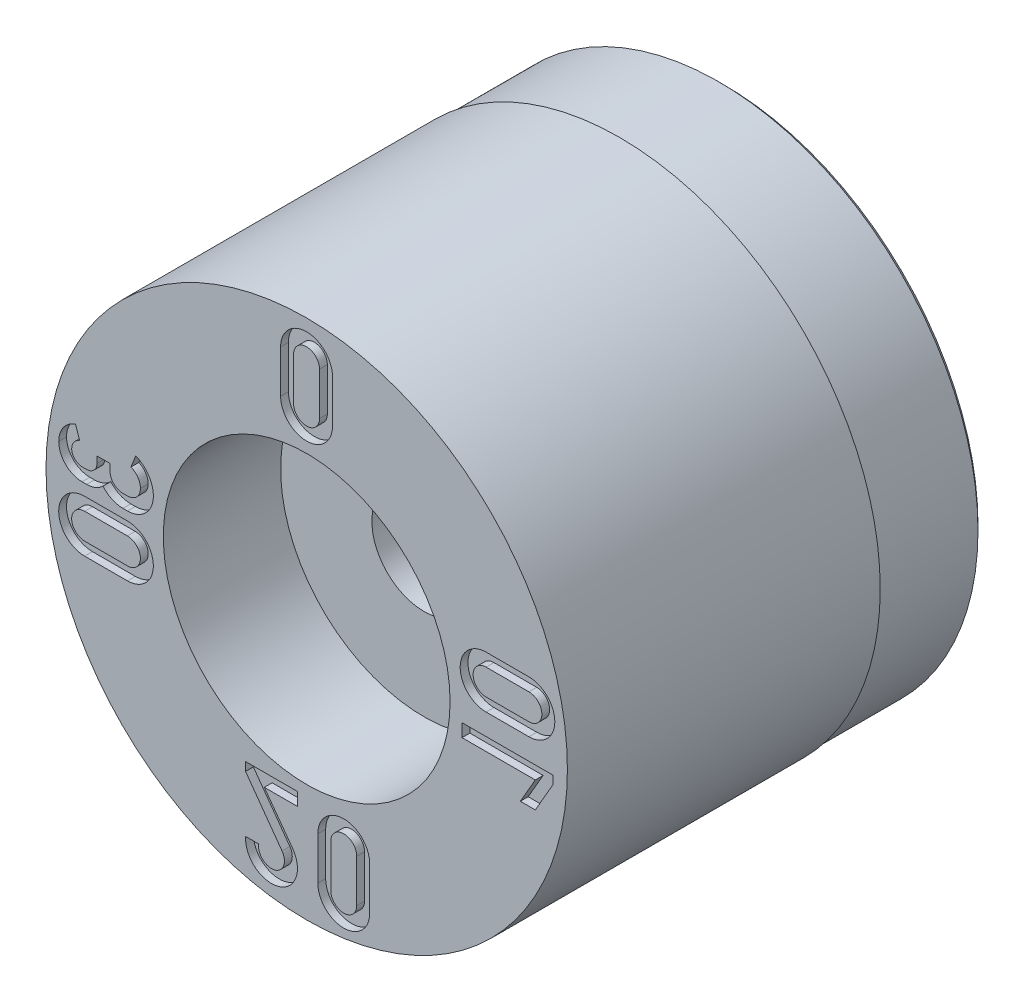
SolidWorks part; units mm, degrees
ref_plane "Front Plane" through (0, 0, 0) normal (0, 0, 1) x (1, 0, 0)
ref_plane "Top Plane" through (0, 0, 0) normal (0, 1, 0) x (1, 0, 0)
ref_plane "Right Plane" through (0, 0, 0) normal (1, 0, 0) x (0, 0, -1)
sketch "Sketch1" plane through (0, 0, 0) normal (1, 0, 0) x (0, 0, -1)
  line L2 (0, 10) -> (0, 5.5)
  line L3 (15.75, 10) -> (0, 10)
  line L4 (-3.7979, 0) -> (49996.2021, 0) construction
  line L8 (16, 2) -> (4.5, 2)
  line L9 (4.5, 5.5) -> (4.5, 2)
  line L10 (4.5, 5.5) -> (0, 5.5)
  line L12 (16, 2) -> (16, 9.75)
  line L16 (16, 9.75) -> (15.75, 10)
  dimension "D1" = 16
  dimension "D2" = 45
  dimension "D3" = 0.25
  dimension "D4" = 20
  dimension "D5" = 11
  dimension "D6" = 4.5
  dimension "D7" = 4
revolve "Revolve1" add sketch "Sketch1" angle 360 about L4
sketch "Sketch4" plane through (0, 0, 0) normal (1, 0, 0) x (0, 0, -1)
  line L0 (0, 0) -> (50000, 0) construction
  line L1 (16, -9.75) -> (16, 9.75) construction
  line L2 (12, 10.935) -> (16, 10.935)
  line L3 (12, 10.935) -> (12, 9.935)
  line L4 (12, 9.935) -> (16, 9.935)
  line L5 (16, 10.935) -> (16, 9.935)
  line L6 (15.75, 10) -> (0, 10) construction
  line L9 (0, 11) -> (0, -11) construction
  dimension "D1" = 1
  dimension "D2" = 0.065
  dimension "D3" = 12
revolve "Cut-Revolve1" cut sketch "Sketch4" angle 360 about L0
sketch "Sketch2" plane through (0, 0, 0) normal (0, 0, 1) x (1, 0, 0)
  line L920 (0.9244, -6.9204) -> (0.9245, -8.5617)
  line L921 (1.9191, -8.5616) -> (1.9192, -6.9203)
  line L922 (2.4167, -8.5616) -> (2.4168, -6.9203)
  line L923 (0.4268, -6.9205) -> (0.4269, -8.5618)
  line L924 (-6.8757, 0.6489) -> (-7.0498, 0.649)
  line L925 (-7.547, 1.1462) -> (-7.547, 1.3949)
  line L926 (-7.547, 1.3949) -> (-8.0444, 1.3949)
  line L927 (-8.0444, 1.3949) -> (-8.0444, 1.1463)
  line L928 (-8.4423, 0.7485) -> (-8.6164, 0.7485)
  line L929 (-8.7099, 1.5704) -> (-8.869, 2.0417)
  line L930 (-8.6164, 0.2511) -> (-8.4424, 0.2511)
  line L931 (-7.0498, 0.1515) -> (-6.8757, 0.1515)
  line L932 (-6.5578, 2.1409) -> (-6.7404, 1.6784)
  line L933 (8.5223, 2.3406) -> (6.8811, 2.3407)
  line L934 (6.8812, 0.351) -> (8.5225, 0.3511)
  line L935 (6.8811, 0.8484) -> (8.5225, 0.8485)
  line L936 (8.5224, 1.8431) -> (6.881, 1.8433)
  line L937 (9.4392, -0.4641) -> (9.4392, -0.7915)
  line L938 (9.4392, -0.7915) -> (8.7696, -1.9562)
  line L939 (8.7696, -1.9562) -> (8.196, -1.9562)
  line L940 (8.196, -1.9562) -> (8.7677, -0.9614)
  line L941 (8.7677, -0.9614) -> (5.9577, -0.9617)
  line L942 (5.9577, -0.9617) -> (5.9577, -0.4644)
  line L943 (5.9577, -0.4644) -> (9.4392, -0.4641)
  line L944 (-0.356, -6.4035) -> (-0.3561, -5.9061)
  line L945 (-0.3561, -5.9061) -> (-2.3455, -5.9062)
  line L946 (-2.3455, -5.9062) -> (-2.3455, -6.2352)
  line L947 (-2.3455, -6.2352) -> (-0.9467, -8.1767)
  line L948 (-1.8423, -8.3929) -> (-2.3425, -8.393)
  line L949 (-0.5425, -7.8856) -> (-1.6244, -6.4036)
  line L950 (-1.6244, -6.4036) -> (-0.356, -6.4035)
  line L951 (-1.0008, 8.5448) -> (-1.0006, 6.9035)
  line L952 (0.9891, 6.9036) -> (0.9892, 8.5449)
  line L953 (0.4917, 6.9036) -> (0.4915, 8.5449)
  line L954 (-0.5031, 8.5448) -> (-0.5032, 6.9035)
  line L955 (-6.8771, -1.6731) -> (-8.5183, -1.6727)
  line L956 (-8.5182, -0.6781) -> (-6.8769, -0.678)
  line L957 (-8.5182, -0.1805) -> (-6.8769, -0.1807)
  line L958 (-6.877, -2.1704) -> (-8.5184, -2.1703)
  arc A432 (1.9192, -6.9203) -> (0.9244, -6.9204) centre (1.4218, -6.9203) ccw
  arc A433 (0.9245, -8.5617) -> (1.9191, -8.5616) centre (1.4218, -8.5617) ccw
  arc A434 (2.4168, -6.9203) -> (0.4268, -6.9205) centre (1.4218, -6.9203) ccw
  arc A435 (0.4269, -8.5618) -> (2.4167, -8.5616) centre (1.4218, -8.5617) ccw
  arc A436 (-6.3783, 1.1462) -> (-6.7404, 1.6784) centre (-6.9504, 1.1463) ccw
  arc A437 (-6.8757, 0.6489) -> (-6.3783, 1.1462) centre (-6.8757, 1.1463) ccw
  arc A438 (-7.547, 1.1462) -> (-7.0498, 0.649) centre (-7.0497, 1.1462) ccw
  arc A439 (-8.4423, 0.7485) -> (-8.0444, 1.1463) centre (-8.4423, 1.1464) ccw
  arc A440 (-9.0142, 1.1464) -> (-8.6164, 0.7485) centre (-8.616, 1.1468) ccw
  arc A441 (-8.7099, 1.5704) -> (-9.0142, 1.1464) centre (-8.5672, 1.1468) ccw
  arc A442 (-8.869, 2.0417) -> (-9.5116, 1.1465) centre (-8.5664, 1.1462) ccw
  arc A443 (-9.5116, 1.1465) -> (-8.6164, 0.2511) centre (-8.6164, 1.1463) ccw
  arc A444 (-8.4424, 0.2511) -> (-7.8136, 0.5091) centre (-8.4423, 1.1459) ccw
  arc A445 (-7.8136, 0.5091) -> (-7.0498, 0.1515) centre (-7.05, 1.1458) ccw
  arc A446 (-6.8757, 0.1515) -> (-5.881, 1.1461) centre (-6.8756, 1.1461) ccw
  arc A447 (-5.881, 1.1461) -> (-6.5578, 2.1409) centre (-6.9506, 1.1461) ccw
  arc A448 (6.8811, 2.3407) -> (6.8812, 0.351) centre (6.8811, 1.3458) ccw
  arc A449 (8.5225, 0.3511) -> (8.5223, 2.3406) centre (8.5224, 1.3458) ccw
  arc A450 (6.881, 1.8433) -> (6.8811, 0.8484) centre (6.8811, 1.3458) ccw
  arc A451 (8.5225, 0.8485) -> (8.5224, 1.8431) centre (8.5224, 1.3458) ccw
  arc A452 (-1.8423, -8.3929) -> (-0.9467, -8.1767) centre (-1.3504, -8.4675) ccw
  arc A453 (-2.3425, -8.393) -> (-0.5425, -7.8856) centre (-1.3501, -8.467) ccw
  arc A454 (-1.0006, 6.9035) -> (0.9891, 6.9036) centre (-0.0058, 6.9036) ccw
  arc A455 (0.9892, 8.5449) -> (-1.0008, 8.5448) centre (-0.0058, 8.5448) ccw
  arc A456 (-0.5032, 6.9035) -> (0.4917, 6.9036) centre (-0.0058, 6.9036) ccw
  arc A457 (0.4915, 8.5449) -> (-0.5031, 8.5448) centre (-0.0058, 8.5448) ccw
  arc A458 (-6.8771, -1.6731) -> (-6.8769, -0.678) centre (-6.877, -1.1755) ccw
  arc A459 (-8.5182, -0.6781) -> (-8.5183, -1.6727) centre (-8.5183, -1.1754) ccw
  arc A460 (-6.877, -2.1704) -> (-6.8769, -0.1807) centre (-6.877, -1.1755) ccw
  arc A461 (-8.5182, -0.1805) -> (-8.5184, -2.1703) centre (-8.5183, -1.1754) ccw
  point P1778 (0, 0.016)
  point P1779 (0.016, 0.016)
  point P1780 (0.016, 0)
extrude "Cut-Extrude1" cut sketch "Sketch2" against normal blind 0.3
